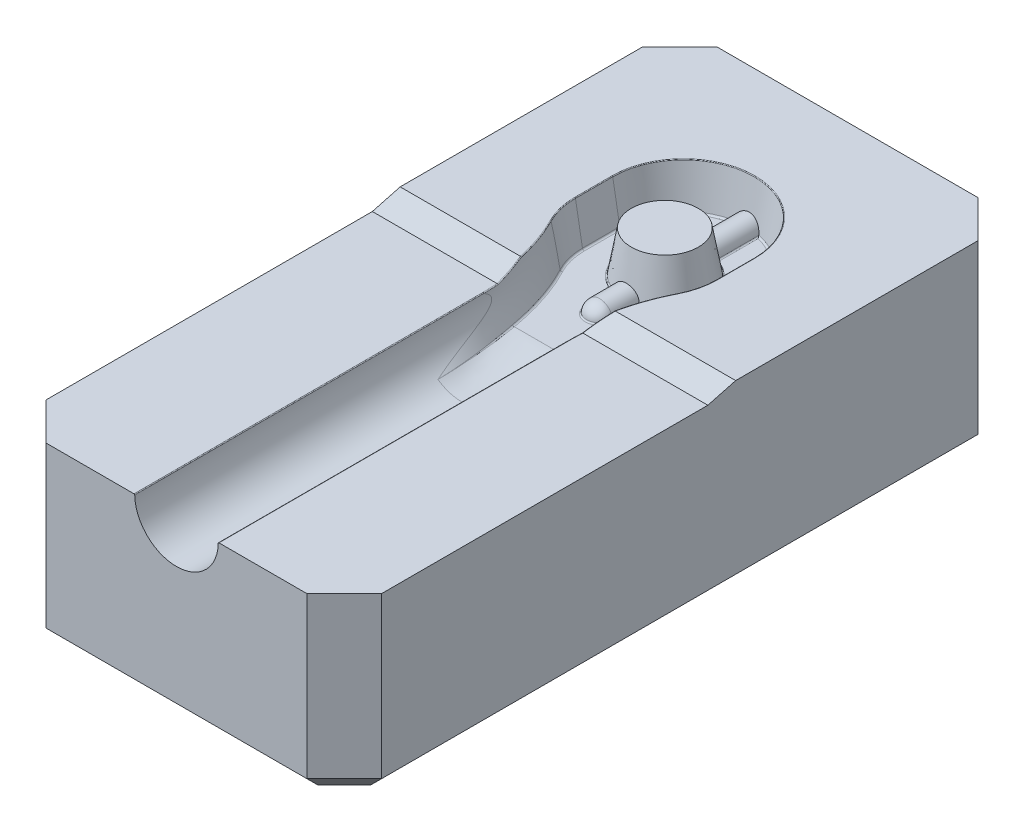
SolidWorks part; units mm, degrees
ref_plane "Ebene vorne" through (0, 0, 0) normal (0, 0, 1) x (1, 0, 0)
ref_plane "Ebene oben" through (0, 0, 0) normal (0, 1, 0) x (1, 0, 0)
ref_plane "Ebene rechts" through (0, 0, 0) normal (1, 0, 0) x (0, 0, -1)
imported_body "Importiert4"
ref_plane "Ebene1" through (0, 0, 0) normal (0.9478, 0, 0.3189) x (0, 1, 0)
sketch "Skizze1" plane through (0, 0, 0) normal (0.9478, 0, 0.3189) x (0, 1, 0)
  line L0 (-11.2, 0) -> (-11.2, -10.9749)
  line L1 (-11.2, -10.9749) -> (0, -9)
  line L2 (0, -9) -> (0, 0)
  line L3 (0, 0) -> (-11.2, 0)
  line L4 (0, 0) -> (-11.2, 0) construction
  dimension "D1" = 11.2
  dimension "D2" = 9
  dimension "D3" = 10.9749
revolve "Rotation1" add sketch "Skizze1" angle 360 about L4
hole_wizard "Bohrung1" positions "Skizze3" profile "Skizze2" legacy
sketch "Skizze3" plane through (0, -50, 0) normal (0, -1, 0) x (1, 0, 0)
  point P0 (-25, -29)
sketch "Skizze2" plane through (-25, -50, -29) normal (1, 0, 0) x (0, 0, -1)
  line L0 (0, 0) -> (0, 27.5537)
  line L1 (0, 27.5537) -> (4.25, 25)
  line L2 (4.25, 25) -> (4.25, 0)
  line L4 (4.25, 0) -> (0, 0)
  line L6 (0, 27.5537) -> (-4.25, 25) construction
  line L7 (0, -4.2442) -> (0, 117.3081) construction
  dimension "Durchmesser" = 8.5
  dimension "Tiefe" = 25
  dimension "Spitzenwinkel" = 118
hole_wizard "Bohrung2" positions "Skizze5" profile "Skizze4" legacy
sketch "Skizze5" plane through (0, -50, 0) normal (0, -1, 0) x (1, 0, 0)
  point P0 (25, -29)
sketch "Skizze4" plane through (25, -50, -29) normal (1, 0, 0) x (0, 0, -1)
  line L0 (0, 0) -> (0, 27.5537)
  line L1 (0, 27.5537) -> (4.25, 25)
  line L2 (4.25, 25) -> (4.25, 0)
  line L4 (4.25, 0) -> (0, 0)
  line L6 (0, 27.5537) -> (-4.25, 25) construction
  line L7 (0, -4.2442) -> (0, 117.3081) construction
  dimension "Durchmesser" = 8.5
  dimension "Tiefe" = 25
  dimension "Spitzenwinkel" = 118
hole_wizard "Bohrung3" positions "Skizze7" profile "Skizze6" legacy
sketch "Skizze7" plane through (0, -50, 0) normal (0, -1, 0) x (1, 0, 0)
  point P0 (25, 111)
sketch "Skizze6" plane through (25, -50, 111) normal (1, 0, 0) x (0, 0, -1)
  line L0 (0, 0) -> (0, 27.5537)
  line L1 (0, 27.5537) -> (4.25, 25)
  line L2 (4.25, 25) -> (4.25, 0)
  line L4 (4.25, 0) -> (0, 0)
  line L6 (0, 27.5537) -> (-4.25, 25) construction
  line L7 (0, -4.2442) -> (0, 117.3081) construction
  dimension "Durchmesser" = 8.5
  dimension "Tiefe" = 25
  dimension "Spitzenwinkel" = 118
hole_wizard "Bohrung4" positions "Skizze9" profile "Skizze8" legacy
sketch "Skizze9" plane through (0, -50, 0) normal (0, -1, 0) x (1, 0, 0)
  point P0 (-25, 111)
sketch "Skizze8" plane through (-25, -50, 111) normal (1, 0, 0) x (0, 0, -1)
  line L0 (0, 0) -> (0, 27.5537)
  line L1 (0, 27.5537) -> (4.25, 25)
  line L2 (4.25, 25) -> (4.25, 0)
  line L4 (4.25, 0) -> (0, 0)
  line L6 (0, 27.5537) -> (-4.25, 25) construction
  line L7 (0, -4.2442) -> (0, 117.3081) construction
  dimension "Durchmesser" = 8.5
  dimension "Tiefe" = 25
  dimension "Spitzenwinkel" = 118
chamfer "Fase1" distance 10 angle 45 1 edges at (-45, -25, -49)
chamfer "Fase2" distance 10 angle 45 1 edges at (45, -26, 131)
chamfer "Fase3" distance 10 angle 45 1 edges at (45, -25, -49)
chamfer "Fase4" distance 10 angle 45 1 edges at (-45, -26, 131)
chamfer "Fase5" distance 5 angle 45 8 edges at (0, -50, 131) (40, -50, 126) (-40, -50, 126) (45, -50, 41) (-45, -50, 41) (40, -50, -44) (-40, -50, -44) (0, -50, -49)
sketch "Skizze10" plane through (0, -11.2, 0) normal (0, 1, 0) x (1, 0, 0)
  line L0 (-8.6968, -31.9835) -> (8.6968, -31.9835)
  line L7 (3.5, -10.4018) -> (3.5, -17.5)
  line L8 (-3.5, -17.5) -> (-3.5, -10.4018)
  line L9 (-3.5, 10.4018) -> (-3.5, 21.6615)
  line L10 (-17.0251, 5) -> (-17.0251, -5)
  line L11 (-6.3875, -54.4835) -> (6.3875, -54.4835)
  line L12 (17.0251, -5) -> (17.0251, 5)
  line L13 (3.5, 21.6615) -> (3.5, 10.4018)
  line L18 (-6.3875, -54.4835) -> (6.3875, -54.4835)
  arc A7 (3.5, -10.4018) -> (3.5, 10.4018) centre (0, 0) ccw
  arc A8 (-3.5, -17.5) -> (3.5, -17.5) centre (0, -17.5) ccw
  arc A9 (-3.5, 10.4018) -> (-3.5, -10.4018) centre (0, 0) ccw
  arc A10 (-3.5, 21.6615) -> (-17.0251, 5) centre (0, 5) ccw
  arc A11 (-17.0251, -5) -> (-15.0375, -12.983) centre (0, -5) ccw
  arc A12 (15.0375, -12.9831) -> (17.0251, -5) centre (0, -5) ccw
  arc A13 (17.0251, 5) -> (3.5, 21.6615) centre (0, 5) ccw
  spline S2 degree 3 poles (-1946.1663, -509.1399) (-343.8045, 64.2911) (-52.1045, 77.201) (-12.424, -18.6358) (-12.1026, -19.4656) (-11.4961, -21.1406) (-11.2107, -21.9866) (-10.4084, -24.5369) (-9.9447, -26.2559) (-9.1306, -29.7237) (-8.7795, -31.4736) (-8.1602, -34.9827) (-7.8914, -36.7435) (-7.4134, -40.274) (-7.2041, -42.0446) (-6.8425, -45.5903) (-6.6896, -47.3649) (-2.4225, -114.229) (-49.3454, -182.623) (-1977.9295, -372.8567) knots -7.101962 -7.101962 -7.101962 -7.101962 0.125 0.125 0.1875 0.1875 0.25 0.25 0.375 0.375 0.5 0.5 0.625 0.625 0.75 0.75 0.875 0.875 5.452903 5.452903 5.452903 5.452903 only from (-15.0375, -12.983) to (-6.3875, -54.4835)
  spline S3 degree 3 poles (1971.2529, -411.6423) (49.0003, -183.2758) (2.4314, -114.0558) (6.6899, -47.3613) (6.8428, -45.5873) (7.2042, -42.044) (7.4133, -40.2748) (7.8917, -36.7414) (8.1611, -34.9773) (8.7805, -31.4682) (9.1309, -29.7221) (9.7418, -27.1204) (9.9597, -26.2561) (10.4282, -24.5343) (10.6788, -23.677) (40.9119, 72.3741) (287.3464, 81.539) (1955.3234, -474.2947) knots -4.440588 -4.440588 -4.440588 -4.440588 0.125 0.125 0.25 0.25 0.375 0.375 0.5 0.5 0.625 0.625 0.6875 0.6875 0.75 0.75 7.753526 7.753526 7.753526 7.753526 only from (6.3875, -54.4835) to (15.0375, -12.9831)
  spline S4 degree 3 poles (-8.6968, -31.9835) (-8.6187, -32.398) (-8.5431, -32.813) (-8.1602, -34.9827) (-7.8914, -36.7435) (-7.4134, -40.274) (-7.2041, -42.0446) (-6.8425, -45.5903) (-6.6896, -47.3649) (-6.4628, -50.9193) (-6.3875, -52.699) (-6.3875, -54.4835) knots 0.470421 0.470421 0.470421 0.470421 0.5 0.5 0.625 0.625 0.75 0.75 0.875 0.875 1 1 1 1
  spline S5 degree 3 poles (6.3875, -54.4835) (6.3875, -52.6966) (6.463, -50.916) (6.6899, -47.3613) (6.8428, -45.5873) (7.2042, -42.044) (7.4133, -40.2748) (7.8917, -36.7414) (8.1611, -34.9773) (8.5438, -32.8092) (8.6191, -32.3961) (8.6968, -31.9835) knots 0 0 0 0 0.125 0.125 0.25 0.25 0.375 0.375 0.5 0.5 0.529463 0.529463 0.529463 0.529463
  dimension "D2" = 22.5
  dimension "D1" = 0
extrude "Linear austragen1" cut sketch "Skizze10" against normal through all
sketch "Skizze11" plane through (0, 0, 54.4835) normal (0, 0, -1) x (-1, 0, 0)
  line L3 (-6.3875, -11.2) -> (-6.3875, -50)
  line L4 (-6.3875, -50) -> (6.3875, -50)
  line L5 (6.3875, -50) -> (6.3875, -11.2)
  line L6 (-6.3875, -11.2) -> (-6.3875, -50)
  line L7 (-6.3875, -50) -> (6.3875, -50)
  line L8 (6.3875, -50) -> (6.3875, -11.2)
  arc A0 (-6.3875, -11.2) -> (6.3875, -11.2) centre (0, -2) ccw
  arc A1 (-6.3875, -11.2) -> (6.3875, -11.2) centre (0, -2) ccw
  dimension "D1" = 0
sketch "Skizze12" plane through (0, 0, 31.9835) normal (0, 0, 1) x (1, 0, 0)
  line L4 (8.6967, -11.2002) -> (-8.6968, -11.2)
  line L5 (-8.6968, -11.2) -> (-8.6968, -50)
  line L6 (-8.6968, -50) -> (8.6968, -50)
  line L7 (8.6968, -50) -> (8.6967, -11.2002)
  line L8 (8.6967, -11.2002) -> (-8.6968, -11.2)
  line L9 (-8.6968, -11.2) -> (-8.6968, -50)
  line L10 (-8.6968, -50) -> (8.6968, -50)
  line L11 (8.6968, -50) -> (8.6967, -11.2002)
  dimension "D1" = 0
sketch3d "3D-Skizze1"
  spline S0 degree 3 poles (34.5338, -6.9476, 2053.9509) (-9.6233, -11.2096, 20.6143) (-6.2179, -11.2009, 66.0131) (-6.3993, -11.1999, 53.2111) (-6.4155, -11.1999, 52.5232) (-6.4424, -11.2001, 51.7005) (-6.4921, -11.1994, 50.569) (-6.5706, -11.2001, 49.174) (-6.6707, -11.2003, 47.7482) (-6.8141, -11.1998, 45.9727) (-7.0161, -11.2001, 43.8163) (-7.3091, -11.2, 41.1595) (-7.6487, -11.1999, 38.4775) (-8.0304, -11.2005, 35.8326) (-8.3551, -11.1999, 33.8659) (-12.4215, -11.2014, 11.166) (-24.8508, -11.1787, -18.1095) (328.524, -6.2574, 2003.2642) knots -1.462772 -1.462772 -1.462772 -1.462772 0.026934 0.055624 0.086026 0.118091 0.164678 0.236069 0.303196 0.354041 0.472054 0.590119 0.708141 0.830201 0.94413 0.972205 3.891417 3.891417 3.891417 3.891417 only from (-6.3875, -11.2, 54.4835) to (-8.6968, -11.2, 31.9835) construction
  spline S1 degree 3 poles (-6.3875, -11.2, 54.4835) (-6.3875, -11.2, 54.3042) (-6.3892, -11.2, 53.9222) (-6.3993, -11.1999, 53.2111) (-6.4155, -11.1999, 52.5232) (-6.4424, -11.2001, 51.7005) (-6.4921, -11.1994, 50.569) (-6.5706, -11.2001, 49.174) (-6.6707, -11.2003, 47.7482) (-6.8141, -11.1998, 45.9727) (-7.0161, -11.2001, 43.8163) (-7.3091, -11.2, 41.1595) (-7.6487, -11.1999, 38.4775) (-8.0304, -11.2005, 35.8326) (-8.3551, -11.1999, 33.8659) (-8.5807, -11.2, 32.6068) (-8.658, -11.2, 32.1899) (-8.6968, -11.2, 31.9835) knots 0 0 0 0 0.026934 0.055624 0.086026 0.118091 0.164678 0.236069 0.303196 0.354041 0.472054 0.590119 0.708141 0.830201 0.94413 0.972205 1 1 1 1
sketch3d "3D-Skizze2"
  spline S0 degree 3 poles (1971.2659, -11.1965, 411.6387) (49.0008, -11.1986, 183.276) (2.4315, -11.1994, 114.0559) (6.6899, -11.2001, 47.3613) (6.8427, -11.2001, 45.5873) (7.2042, -11.2001, 42.044) (7.4133, -11.2002, 40.2748) (7.8916, -11.2002, 36.7414) (8.1611, -11.2002, 34.9773) (23.0274, -11.2011, -49.248) (127.5298, -11.2018, -113.1955) (1997.6852, -11.1988, 186.4728) knots -8.386977 -8.386977 -8.386977 -8.386977 0.236088 0.236088 0.472176 0.472176 0.708264 0.708264 0.944352 0.944352 12.041538 12.041538 12.041538 12.041538 only from (6.3875, -11.2, 54.4835) to (8.6967, -11.2002, 31.9835) construction
  spline S1 degree 3 poles (6.3875, -11.2, 54.4835) (6.3875, -11.2, 52.6966) (6.463, -11.2, 50.916) (6.6899, -11.2001, 47.3613) (6.8427, -11.2001, 45.5873) (7.2042, -11.2001, 42.044) (7.4133, -11.2002, 40.2748) (7.8916, -11.2002, 36.7414) (8.1611, -11.2002, 34.9773) (8.5437, -11.2002, 32.8092) (8.619, -11.2002, 32.3961) (8.6967, -11.2002, 31.9835) knots 0 0 0 0 0.236088 0.236088 0.472176 0.472176 0.708264 0.708264 0.944352 0.944352 1 1 1 1
loft "Ausformung1" add profiles "Skizze11", "Skizze12"
fillet "Verrundung1" radius 0.2 13 edges at (14.3649, 0, 19.6109) (19, 0, 0) (0, 0, -24) (-19, 0, 0) (-14.4609, 0, 19.3421)
fillet "Verrundung2" radius 0.5 10 edges at (13.2182, -11.2, -15.73) (17.0251, -11.2, 0) (-13.2182, -11.2, -15.73) (-17.0251, -11.2, 0)
fillet "Verrundung3" radius 0.35 10 edges at (0, -11.2, 21) (-3.5, -11.2, 13.9509) (-3.5, -11.2, -15.8172) (3.5, -11.2, 13.9509) (-0.2477, -7.7088, -10.3563) (0.2477, -7.7088, 10.3563) (-10.9749, -11.2, 0) (10.9749, -11.2, 0) (3.5, -11.2, -15.8172) (3.4981, -11.0859, -21.558)
